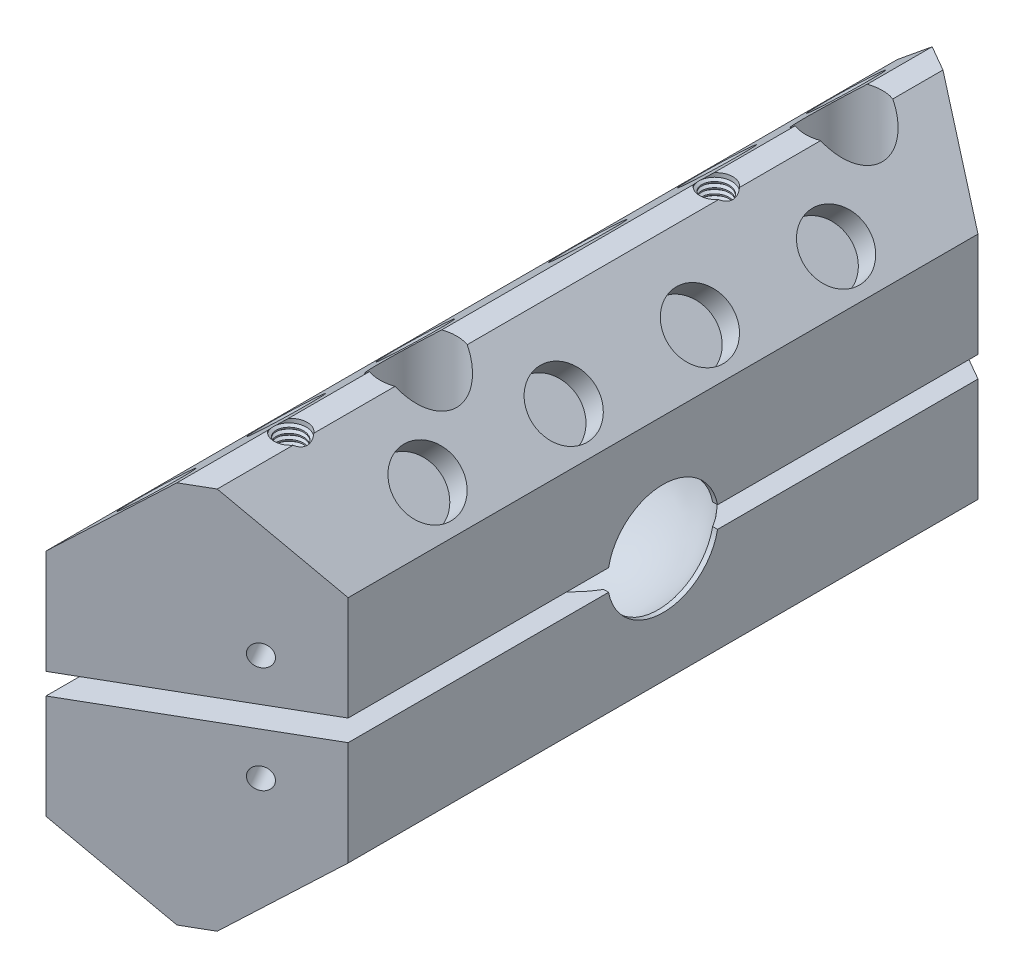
SolidWorks part; units mm, degrees
ref_plane "Plan de face" through (0, 0, 0) normal (0, 0, 1) x (1, 0, 0)
ref_plane "Plan de dessus" through (0, 0, 0) normal (0, 1, 0) x (1, 0, 0)
ref_plane "Plan de droite" through (0, 0, 0) normal (1, 0, 0) x (0, 0, -1)
sketch "Esquisse1" plane through (0, 0, 0) normal (0, 0, 1) x (1, 0, 0)
  line L0 (22.5, 0) -> (-22.5, 0)
  line L1 (-22.5, 0) -> (-22.5, 24.5)
  line L2 (-22.5, 24.5) -> (-3, 42.5)
  line L3 (-3, 42.5) -> (3, 42.5)
  line L4 (0, 42.5) -> (0, 0) construction
  line L5 (22.5, 24.5) -> (3, 42.5)
  line L6 (22.5, 0) -> (22.5, 24.5)
  dimension "D1" = 22.5
  dimension "D2" = 24.5
  dimension "D3" = 42.5
  dimension "D4" = 3
extrude "Boss.-Extru.1" add sketch "Esquisse1" along normal mid plane 200
sketch "Esquisse3" plane through (0, 0, 0) normal (0, 1, 0) x (1, 0, 0)
  line L0 (-22.5, -100) -> (22.5, -74)
  line L1 (22.5, -100) -> (22.5, 100) construction
  line L2 (22.5, -74) -> (37.4544, -74)
  line L3 (37.4544, -74) -> (37.4544, -114.3206)
  line L4 (37.4544, -114.3206) -> (-22.5, -114.3206)
  line L5 (-22.5, -114.3206) -> (-22.5, -100)
  line L6 (0, 0) -> (41.3695, 0) construction
  line L7 (-22.5, 114.3206) -> (-22.5, 100)
  line L8 (37.4544, 114.3206) -> (-22.5, 114.3206)
  line L9 (37.4544, 74) -> (37.4544, 114.3206)
  line L10 (22.5, 74) -> (37.4544, 74)
  line L11 (-22.5, 100) -> (22.5, 74)
  point P16 (29.9772, -74)
  point P17 (0, 0)
  dimension "D1" = 74
extrude "Enlèv. mat.-Extru.6" cut sketch "Esquisse3" against normal mid plane 200 contours L5 L4 L3 L2 L0 | L7 L11 L10 L9 L8
ref_plane "Plan1" through (0, -2.5, 0) normal (0, -1, 0) x (-1, 0, 0)
mirror "Symétrie5" about plane through (0, -2.5, 0) normal (0, -1, 0)
sketch "Esquisse4" plane through (0, 42.5, 0) normal (0, 1, 0) x (1, 0, 0)
  line L0 (0, 0) -> (0, 35) construction
  line L1 (0, 35) -> (0, 65) construction
  line L2 (0, 0) -> (0, -35) construction
  line L3 (0, -35) -> (0, -65) construction
  circle A0 centre (0, -65) radius 3.875
  circle A1 centre (0, -35) radius 3.875
  circle A3 centre (0, 35) radius 3.875
  circle A4 centre (0, 65) radius 3.875
  dimension "D5" = 7.75
  dimension "D6" = 7.75
  dimension "D1" = 35
  dimension "D2" = 35
  dimension "D3" = 30
  dimension "D4" = 30
extrude "Enlèv. mat.-Extru.7" cut sketch "Esquisse4" against normal through all and the other way through all
sketch "Esquisse7" plane through (0, 42.5, 0) normal (0, 1, 0) x (1, 0, 0)
  circle A0 centre (0, 65) radius 9
  circle A1 centre (0, -35) radius 9
  dimension "D1" = 18
extrude "Enlèv. mat.-Extru.8" cut sketch "Esquisse7" against normal blind 20
sketch "Esquisse10" plane through (0, -47.5, 0) normal (0, -1, 0) x (1, 0, 0)
  circle A1 centre (0, -35) radius 9
  circle A2 centre (0, 65) radius 9
  dimension "D1" = 18
extrude "Enlèv. mat.-Extru.9" cut sketch "Esquisse10" against normal blind 20 contours A2 | A1
sketch "Esquisse18" plane through (0, 22.5, 0) normal (0, 1, 0) x (1, 0, 0)
  circle A0 centre (0, 65) radius 4.25
  circle A1 centre (0, -35) radius 4.25
  dimension "D1" = 8.5
  dimension "D2" = 8.5
extrude "Enlèv. mat.-Extru.15" cut sketch "Esquisse18" against normal up to surface (22.5 mm away)
sketch "Esquisse19" plane through (0, -27.5, 0) normal (0, -1, 0) x (1, 0, 0)
  circle A0 centre (0, 65) radius 4.25
  circle A1 centre (0, -35) radius 4.25
  dimension "D1" = 8.5
  dimension "D2" = 8.5
extrude "Enlèv. mat.-Extru.16" cut sketch "Esquisse19" against normal up to surface (22.5 mm away)
thread "Filetage2" pitch 1.25 start angle 0, offset 0, length 41, pitch 1.25, diameter 7.75
ref_plane "Plan4" through (3.875, 0, 65) normal (0, 0, 1) x (1, 0, 0)
sketch "Profil de filetage2" plane through (3.875, 0, 65) normal (0, 0, 1) x (1, 0, 0)
  line L0 (0, 0) -> (0, 1.25) construction
  line L11 (0, 0) -> (0, 1.0937)
  line L12 (0, 1.0937) -> (-0.6766, 0.7031)
  line L13 (-0.6766, 0.7031) -> (-0.6766, 0.3906)
  line L15 (-0.6766, 0.3906) -> (0, 0)
  line L17 (-0.6766, 0.5469) -> (0, 0.5469) construction
  point P2 (0, 0)
  dimension "Pitch" = 1.25
  dimension "Profile_Angle" = 60
  dimension "Profile_Land" = 0.3125
  dimension "Profile_Height" = 0.6766
thread "Filetage3" pitch 1.25 start angle 0, offset 0, length 41, pitch 1.25, diameter 7.75
ref_plane "Plan5" through (3.875, 0, -35) normal (0, 0, 1) x (1, 0, 0)
sketch "Profil de filetage3" plane through (3.875, 0, -35) normal (0, 0, 1) x (1, 0, 0)
  line L0 (0, 0) -> (0, 1.25) construction
  line L11 (0, 0) -> (0, 1.0937)
  line L12 (0, 1.0937) -> (-0.6766, 0.7031)
  line L13 (-0.6766, 0.7031) -> (-0.6766, 0.3906)
  line L15 (-0.6766, 0.3906) -> (0, 0)
  line L17 (-0.6766, 0.5469) -> (0, 0.5469) construction
  point P2 (0, 0)
  dimension "Pitch" = 1.25
  dimension "Profile_Angle" = 60
  dimension "Profile_Land" = 0.3125
  dimension "Profile_Height" = 0.6766
thread "Filetage4" pitch 1.25 start angle 0, offset 0, length 41, pitch 1.25, diameter 7.75
ref_plane "Plan6" through (-3.875, -5, -65) normal (0, 0, 1) x (-1, 0, 0)
sketch "Profil de filetage4" plane through (-3.875, -5, -65) normal (0, 0, 1) x (-1, 0, 0)
  line L0 (0, 0) -> (0, 1.25) construction
  line L11 (0, 0) -> (0, 1.0937)
  line L12 (0, 1.0937) -> (-0.6766, 0.7031)
  line L13 (-0.6766, 0.7031) -> (-0.6766, 0.3906)
  line L15 (-0.6766, 0.3906) -> (0, 0)
  line L17 (-0.6766, 0.5469) -> (0, 0.5469) construction
  point P2 (0, 0)
  dimension "Pitch" = 1.25
  dimension "Profile_Angle" = 60
  dimension "Profile_Land" = 0.3125
  dimension "Profile_Height" = 0.6766
thread "Filetage5" pitch 1.25 start angle 0, offset 0, length 41, pitch 1.25, diameter 7.75
ref_plane "Plan7" through (-3.875, -5, 35) normal (0, 0, 1) x (-1, 0, 0)
sketch "Profil de filetage5" plane through (-3.875, -5, 35) normal (0, 0, 1) x (-1, 0, 0)
  line L0 (0, 0) -> (0, 1.25) construction
  line L11 (0, 0) -> (0, 1.0937)
  line L12 (0, 1.0937) -> (-0.6766, 0.7031)
  line L13 (-0.6766, 0.7031) -> (-0.6766, 0.3906)
  line L15 (-0.6766, 0.3906) -> (0, 0)
  line L17 (-0.6766, 0.5469) -> (0, 0.5469) construction
  point P2 (0, 0)
  dimension "Pitch" = 1.25
  dimension "Profile_Angle" = 60
  dimension "Profile_Land" = 0.3125
  dimension "Profile_Height" = 0.6766
sketch "Esquisse9" plane through (22.5623, 24.4425, 0) normal (0.6783, 0.7348, 0) x (0.7348, -0.6783, 0)
  line L0 (-10.0848, 78.2455) -> (-10.0848, -78.2455) construction
  line L1 (-0.0848, -74) -> (-0.0848, 74) construction
  line L2 (-0.0848, 0) -> (-10.0848, 0)
  line L3 (-0.0848, 74) -> (-26.6225, 85.2667) construction
  line L4 (-0.0848, -74) -> (-26.6225, -85.2667) construction
  line L5 (-10.0848, 16) -> (-18.0561, 16) construction
  line L6 (-10.0848, 48) -> (-18.0561, 48)
  circle A0 centre (-10.0848, 48) radius 7.5
  circle A1 centre (-10.0848, 16) radius 7.5
  circle A2 centre (-10.0848, -16) radius 7.5
  circle A3 centre (-10.0848, -48) radius 7.5
  point P14 (-5.0848, 0)
  dimension "D3" = 15
  dimension "D4" = 10
  dimension "D1" = 16
  dimension "D2" = 32
extrude "Enlèv. mat.-Extru.10" cut sketch "Esquisse9" against normal blind 6
mirror "Symétrie6" about plane through (0, -2.5, 0) normal (0, -1, 0) of "Enlèv. mat.-Extru.10"
sketch "Esquisse11" plane through (-22.5623, 24.4425, 0) normal (-0.6783, 0.7348, 0) x (0.7348, 0.6783, 0)
  line L0 (9.6196, -95.952) -> (9.6196, 95.952) construction
  line L1 (26.6225, -88.7333) -> (0.0848, -100) construction
  line L2 (26.6225, 88.7333) -> (0.0848, 100) construction
  line L3 (0.0848, -100) -> (0.0848, 100) construction
  line L4 (9.6196, -20.25) -> (16.4959, -20.25) construction
  line L5 (9.6196, -50.625) -> (16.4959, -50.625) construction
  line L6 (9.6196, -81) -> (16.4959, -81) construction
  line L7 (0.0848, 0) -> (9.6196, 0) construction
  circle A0 centre (9.6196, -81) radius 7.5
  circle A1 centre (9.6196, -50.625) radius 7.5
  circle A2 centre (9.6196, -20.25) radius 7.5
  circle A3 centre (9.6196, 20.25) radius 7.5
  circle A4 centre (9.6196, 50.625) radius 7.5
  circle A5 centre (9.6196, 81) radius 7.5
  dimension "D4" = 15
  dimension "D1" = 20.25
  dimension "D2" = 30.375
  dimension "D3" = 30.375
extrude "Enlèv. mat.-Extru.11" cut sketch "Esquisse11" against normal blind 6
ref_plane "Plan2" through (0, 0, 0) normal (0, 0, 1) x (1, 0, 0)
sketch "Esquisse12" plane through (37.686, 0, -65.2258) normal (0.5003, 0, -0.8659) x (-0.8659, 0, -0.5003)
  line L0 (69.5097, -5) -> (17.5386, -5) construction
  line L1 (17.5386, -5) -> (17.5386, -29.5) construction
  circle A0 centre (32.5386, -15) radius 2.5
  dimension "D1" = 5
  dimension "D2" = 10
  dimension "D3" = 15
extrude "Enlèv. mat.-Extru.12" cut sketch "Esquisse12" against normal blind 10
mirror "Symétrie7" about plane through (0, 0, 0) normal (0, 0, 1) of "Enlèv. mat.-Extru.12"
mirror "Symétrie8" about plane through (0, -2.5, 0) normal (0, -1, 0) of "Symétrie7", "Enlèv. mat.-Extru.12"
sketch "Esquisse15" plane through (0, -2.5, 0) normal (0, -1, 0) x (-1, 0, 0)
  line L0 (-21.3366, 13.05) -> (-21.3366, -13.05) construction
  line L1 (21.6634, 12.5) -> (21.6634, -12.5)
  line L3 (0.3199, 25.009) -> (0.3199, -25.009) construction
  line L4 (-21.3366, -13.05) -> (-44.8393, -13.05)
  line L5 (-44.8393, -13.05) -> (-44.8393, 0)
  line L6 (-44.8393, 0) -> (34.0231, 0)
  line L7 (34.0231, 0) -> (34.0231, -12.5)
  line L8 (34.0231, -12.5) -> (21.6634, -12.5)
  arc A0 (-21.3366, -13.05) -> (21.6634, -12.5) centre (0, 0) ccw
  arc A1 (21.6634, 12.5) -> (-21.3366, 13.05) centre (0, 0) ccw construction
  dimension "D1" = 26.1
  dimension "D2" = 25
  dimension "D3" = 43
  dimension "D4" = 50.018
revolve "Enlèvement de matière-Révolution2" cut sketch "Esquisse15" angle 360 about L6
